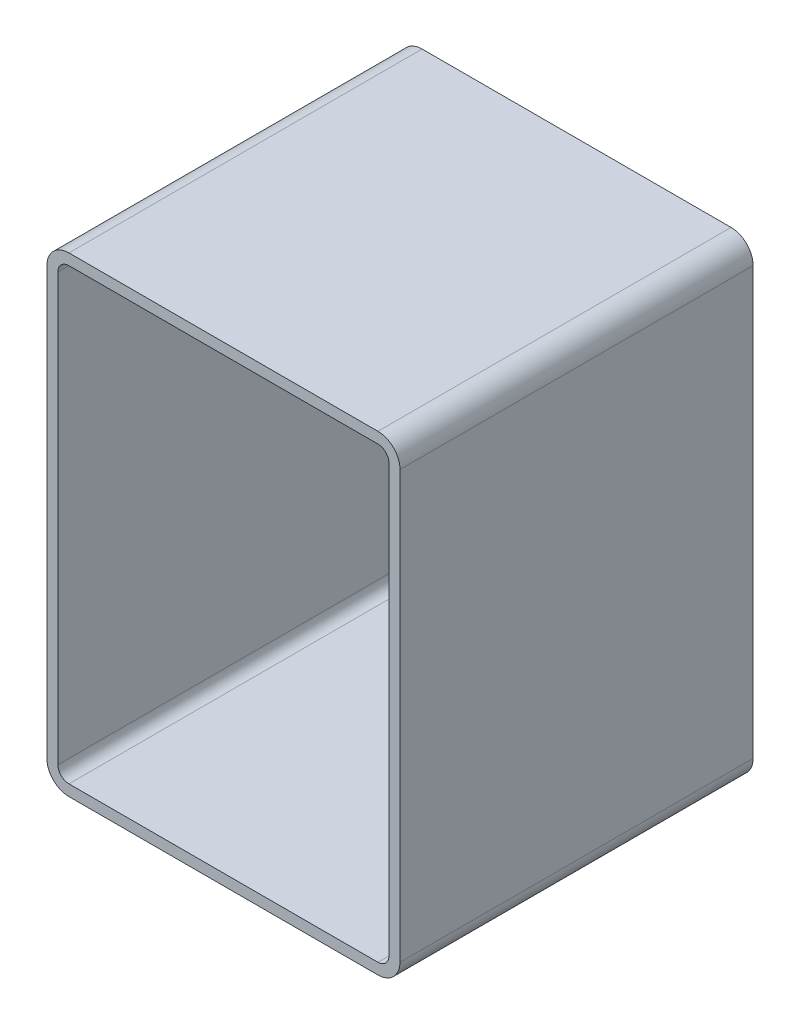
SolidWorks part; units mm, degrees
ref_plane "Front Plane" through (0, 0, 0) normal (0, 0, 1) x (1, 0, 0)
ref_plane "Top Plane" through (0, 0, 0) normal (0, 1, 0) x (1, 0, 0)
ref_plane "Right Plane" through (0, 0, 0) normal (1, 0, 0) x (0, 0, -1)
sketch "Sketch1" plane through (0, 0, 0) normal (0, 0, 1) x (1, 0, 0)
sketch_block_instance "HSS16x12x0.375-1"
sketch_block "HSS16x12x0.375"
extrude "Boss-Extrude1" add sketch "Sketch1" along normal blind 304.8
